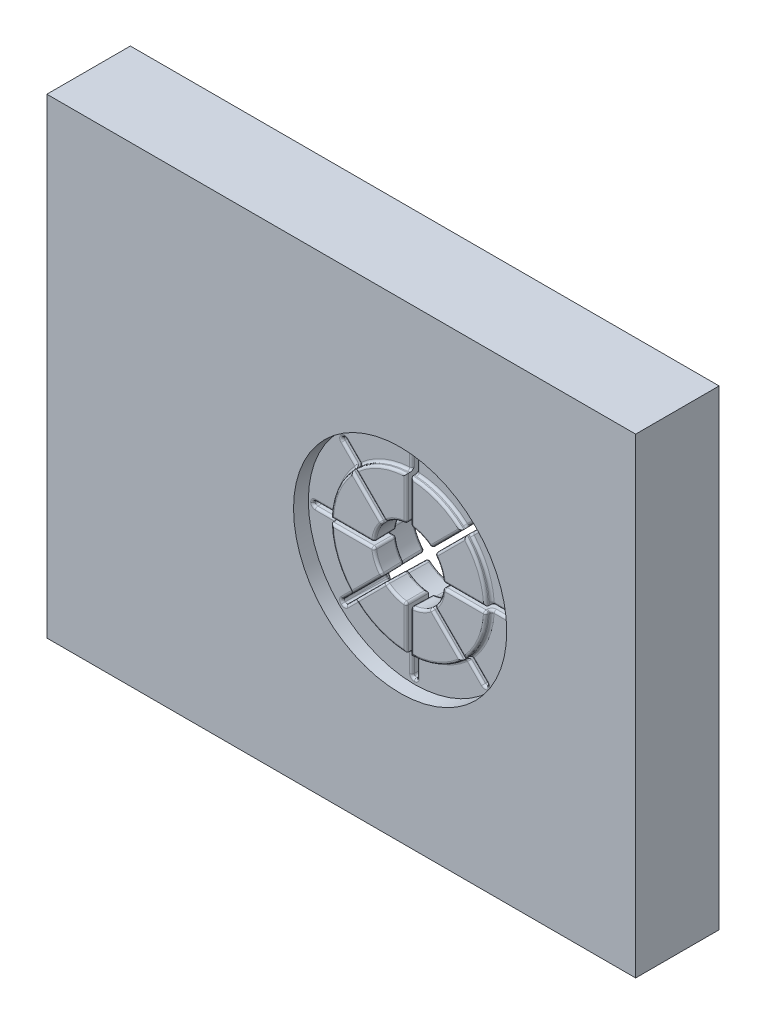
SolidWorks part; units mm, degrees
ref_plane "Plan de face" through (0, 0, 0) normal (0, 0, 1) x (1, 0, 0)
ref_plane "Plan de dessus" through (0, 0, 0) normal (0, 1, 0) x (1, 0, 0)
ref_plane "Plan de droite" through (0, 0, 0) normal (1, 0, 0) x (0, 0, -1)
sketch "Esquisse2" plane through (0, 0, 0) normal (0, 0, 1) x (1, 0, 0)
  line L4 (200, -200) -> (200, 200)
  line L5 (200, 200) -> (-300, 200)
  line L6 (-300, 200) -> (-300, -200)
  line L7 (-300, -200) -> (200, -200)
  line L8 (200, -200) -> (200, 200)
  line L9 (200, 200) -> (-300, 200)
  line L10 (-300, 200) -> (-300, -200)
  line L11 (-300, -200) -> (200, -200)
  dimension "D1" = 0
extrude "Extrusion1" add sketch "Esquisse2" along normal up to surface (70.8861 mm away)
other "Empreinte1"
other "MODELE<1>@E D M1"
